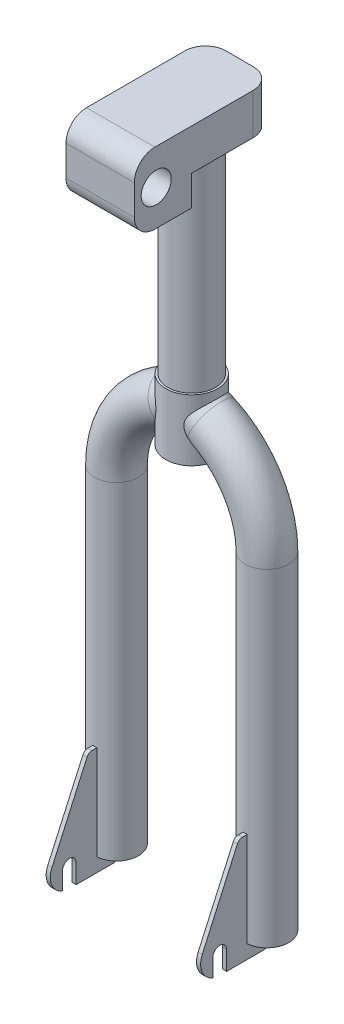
SolidWorks part; units mm, degrees
ref_plane "Plan de face" through (0, 0, 0) normal (0, 0, 1) x (1, 0, 0)
ref_plane "Plan de dessus" through (0, 0, 0) normal (0, 1, 0) x (1, 0, 0)
ref_plane "Plan de droite" through (0, 0, 0) normal (1, 0, 0) x (0, 0, -1)
sketch "Esquisse1" plane through (0, 0, 0) normal (0, 1, 0) x (1, 0, 0)
  circle A0 centre (0, 0) radius 17.5
  circle A1 centre (0, 0) radius 11
  dimension "D1" = 35
  dimension "D2" = 22
extrude "Boss.-Extru.1" add sketch "Esquisse1" along normal blind 152
sketch "Esquisse2" plane through (0, 0, 0) normal (0, -1, 0) x (1, 0, 0)
  circle A0 centre (0, 0) radius 19
  circle A1 centre (0, 0) radius 11 construction
  circle A2 centre (0, 0) radius 11
  dimension "D1" = 38
extrude "Boss.-Extru.2" add sketch "Esquisse2" along normal blind 45
sketch "Esquisse3" plane through (0, 0, 0) normal (0, 0, 1) x (1, 0, 0)
  line L0 (0, -15) -> (14.5833, -21.8003)
  line L1 (55, -85.2418) -> (55, -325)
  line L2 (-19, -45) -> (19, -45) construction
  arc A0 (14.5833, -21.8003) -> (55, -85.2418) centre (-15, -85.2418) cw
  dimension "D3" = 70
  dimension "D1" = 55
  dimension "D2" = 25
  dimension "D4" = 15
  dimension "D5" = 325
ref_plane "Plan1" through (0, -325, 0) normal (0, 1, 0) x (1, 0, 0)
sketch "Esquisse4" plane through (0, -325, 0) normal (0, 1, 0) x (1, 0, 0)
  circle A0 centre (55, 0) radius 16
  dimension "D1" = 32
sweep "Balayage1" add profiles "Esquisse4" path "Esquisse3"
sketch "Esquisse5" plane through (0, -45, 0) normal (0, -1, 0) x (1, 0, 0)
  circle A0 centre (0, 0) radius 11 construction
  circle A1 centre (0, 0) radius 11
extrude "Enlèv. mat.-Extru.1" cut sketch "Esquisse5" against normal through all
ref_plane "Plan2" through (55, 0, 0) normal (1, 0, 0) x (0, 0, -1)
sketch "Esquisse6" plane through (55, 0, 0) normal (1, 0, 0) x (0, 0, -1)
  line L0 (0, -255.7362) -> (-22, -255.7362)
  line L1 (0, -85.2418) -> (0, -325) construction
  line L2 (-22, -255.7362) -> (-48.7682, -315.2578)
  line L3 (-36, -335) -> (0, -335) construction
  line L4 (0, -335) -> (0, -255.7362)
  line L5 (-16, -85.2418) -> (-16, -325) construction
  line L6 (-16, -325) -> (16, -325) construction
  line L7 (-41, -334.0767) -> (-41, -321)
  line L8 (-31, -321) -> (-31, -335)
  line L9 (0, -335) -> (-31, -335)
  arc A0 (-48.7682, -315.2578) -> (-36, -335) centre (-36, -321) ccw construction
  arc A1 (-41, -321) -> (-31, -321) centre (-36, -321) cw
  arc A2 (-48.7682, -315.2578) -> (-41, -334.0767) centre (-36, -321) ccw
  dimension "D1" = 14
  dimension "D2" = 20
  dimension "D3" = 4
  dimension "D4" = 10
  dimension "D5" = 22
extrude "Boss.-Extru.3" add sketch "Esquisse6" along normal mid plane 3
fillet "Congé1" radius 4 2 edges at (55, -255.7362, 22) (55, -335, 0)
mirror "Symétrie1" about plane through (0, 0, 0) normal (1, 0, 0) of "Congé1", "Boss.-Extru.3", "Enlèv. mat.-Extru.1", "Balayage1"
sketch "Esquisse7" plane through (0, 152, 0) normal (0, 1, 0) x (1, 0, 0)
  line L0 (-25, 35) -> (-25, -67)
  line L1 (-25, -67) -> (25, -67)
  line L2 (25, -67) -> (25, 35)
  line L3 (-25, 35) -> (25, 35)
  line L4 (-25, 0) -> (25, 0) construction
  dimension "D1" = 50
  dimension "D2" = 102
  dimension "D3" = 35
extrude "Boss.-Extru.4" add sketch "Esquisse7" along normal blind 30
sketch "Esquisse8" plane through (-25, 0, 0) normal (-1, 0, 0) x (0, 0, 1)
  line L0 (67, 182) -> (25, 182)
  line L1 (67, 182) -> (67, 130)
  line L2 (25, 182) -> (25, 130)
  line L3 (67, 130) -> (25, 130)
  line L4 (-35, 182) -> (67, 182) construction
  dimension "D1" = 42
  dimension "D2" = 52
extrude "Boss.-Extru.5" add sketch "Esquisse8" against normal up to surface (50 mm away) contours L2 L3 L1 L0
fillet "Congé2" radius 15 4 edges at (0, 182, 67) (-25, 167, -35) (25, 167, -35) (0, 130, 67)
sketch "Esquisse9" plane through (25, 0, 0) normal (1, 0, 0) x (0, 0, -1)
  line L0 (-67, 167) -> (-67, 145) construction
  circle A0 centre (-51, 156) radius 11
  point P4 (-67, 156)
  dimension "D1" = 22
  dimension "D2" = 16
extrude "Enlèv. mat.-Extru.2" cut sketch "Esquisse9" against normal through all
